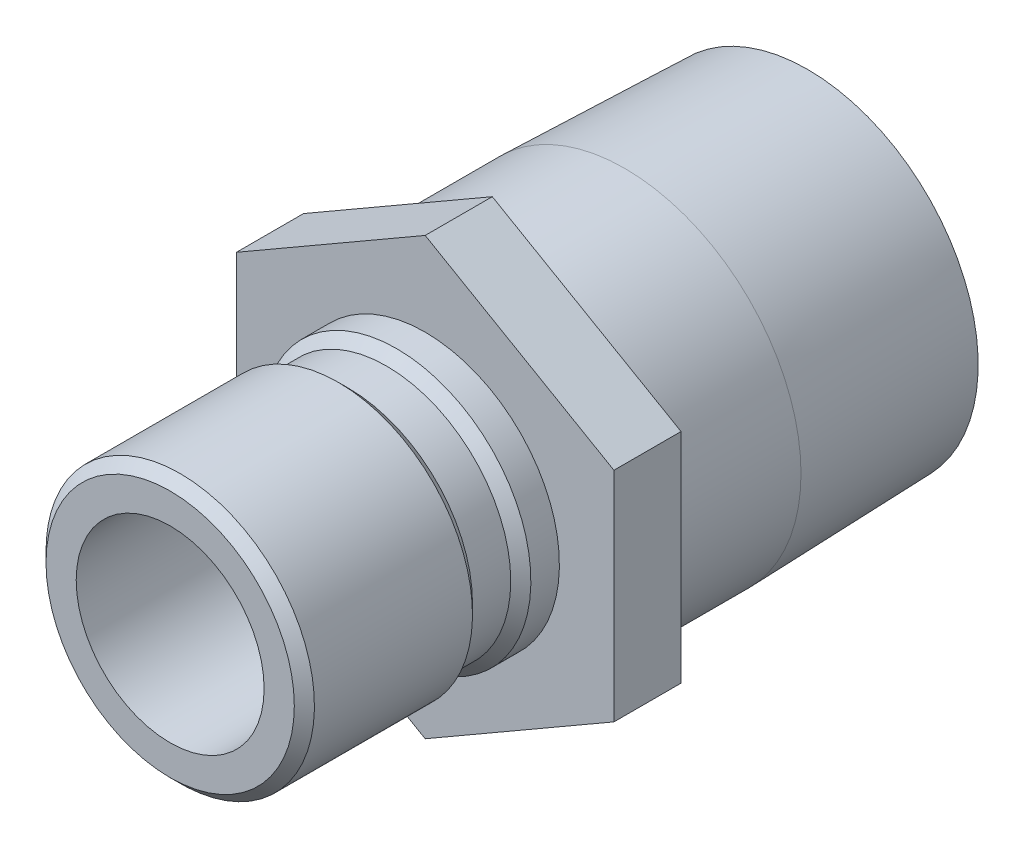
SolidWorks part; units mm, degrees
ref_plane "Front Plane" through (0, 0, 0) normal (0, 0, 1) x (1, 0, 0)
ref_plane "Top Plane" through (0, 0, 0) normal (0, 1, 0) x (1, 0, 0)
ref_plane "Right Plane" through (0, 0, 0) normal (1, 0, 0) x (0, 0, -1)
sketch "Sketch1" plane through (0, 0, 0) normal (1, 0, 0) x (0, 0, -1)
  line L0 (0, 0) -> (-22.479, 0) construction
  line L1 (-19.304, 7.112) -> (-19.304, 9.398)
  line L2 (-5.8166, 9.398) -> (-5.8166, 0) construction
  line L3 (-18.542, 10.16) -> (-6.5786, 10.16)
  line L4 (0, 13.335) -> (0, 0) construction
  line L5 (-5.8166, 9.398) -> (-2.921, 9.398)
  line L6 (-2.159, 10.16) -> (0, 10.16)
  line L7 (0, 10.16) -> (0, 13.335)
  line L8 (-5.8166, 9.398) -> (-6.5786, 10.16)
  line L9 (-2.921, 9.398) -> (-2.159, 10.16)
  line L10 (-19.304, 9.398) -> (-18.542, 10.16)
  line L11 (3.0527, 10.4648) -> (28.956, 10.4648)
  line L12 (0, 13.335) -> (15.113, 13.335)
  line L13 (15.113, 13.335) -> (28.956, 12.9024)
  line L14 (28.956, 12.9024) -> (28.956, 10.4648)
  line L15 (5.08, 0) -> (0, 0) construction
  line L16 (-19.304, 7.112) -> (1.27, 7.112)
  line L17 (1.27, 7.112) -> (3.0527, 10.4648)
  dimension "D1" = 19.304
  dimension "D2" = 2.8956
  dimension "D3" = 0.762
  dimension "D4" = 45
  dimension "D5" = 13.4874
  dimension "D6" = 45
  dimension "D7" = 1.79
  dimension "D8" = 13.843
  dimension "D9" = 48.26
  dimension "D10" = 3.175
  dimension "D11" = 5.08
  dimension "D12" = 20.9296
  dimension "D13" = 26.67
  dimension "D14" = 20.32
  dimension "D15" = 118
  dimension "D16" = 14.224
  dimension "D17" = 20.574
revolve "Revolve1" add sketch "Sketch1" angle 360 about L0
sketch "Sketch2" plane through (0, 0, 0) normal (0, 0, 1) x (1, 0, 0)
  line L1 (-14.2875, 8.2489) -> (-14.2875, -8.2489)
  line L2 (-14.2875, -8.2489) -> (0, -16.4978)
  line L3 (0, -16.4978) -> (14.2875, -8.2489)
  line L4 (14.2875, -8.2489) -> (14.2875, 8.2489)
  line L5 (14.2875, 8.2489) -> (0, 16.4978)
  line L6 (0, 16.4978) -> (-14.2875, 8.2489)
  circle A0 centre (0, 0) radius 14.2875 construction
  circle A1 centre (0, 0) radius 10.4648 construction
  circle A2 centre (0, 0) radius 10.4648
  dimension "D1" = 28.575
extrude "Boss-Extrude1" add sketch "Sketch2" against normal up to vertex (4.445 mm away)
